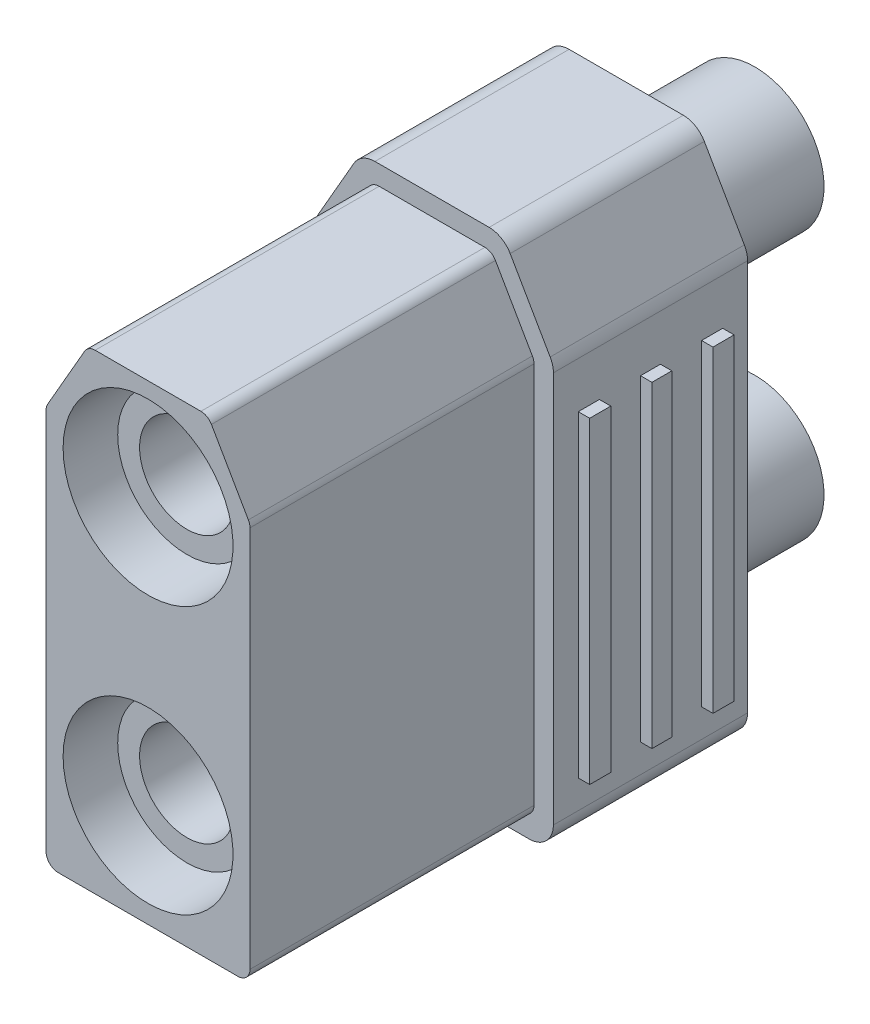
SolidWorks part; units mm, degrees
ref_plane "Front Plane" through (0, 0, 0) normal (0, 0, 1) x (1, 0, 0)
ref_plane "Top Plane" through (0, 0, 0) normal (0, 1, 0) x (1, 0, 0)
ref_plane "Right Plane" through (0, 0, 0) normal (1, 0, 0) x (0, 0, -1)
sketch "Sketch1" plane through (0, 0, 0) normal (0, 0, 1) x (1, 0, 0)
  line L0 (-5, 8.7) -> (-2.931, 12.3)
  line L1 (-5, 8.7) -> (5, 8.7) construction
  line L2 (-5, 8.7) -> (-5, -8.7)
  line L3 (-5, -8.7) -> (5, -8.7)
  line L4 (5, 8.7) -> (5, -8.7)
  line L5 (-5, 8.7) -> (5, -8.7) construction
  line L6 (-5, -8.7) -> (5, 8.7) construction
  line L7 (-2.931, 12.3) -> (2.931, 12.3)
  line L8 (2.931, 12.3) -> (5, 8.7)
  line L9 (0, 0) -> (0, 24.3333) construction
  point P0 (0, 0)
  dimension "D1" = 10
  dimension "D2" = 21
  dimension "D3" = 3.6
extrude "Boss-Extrude1" add sketch "Sketch1" along normal blind 8
sketch "Sketch2" plane through (0, 0, 8) normal (0, 0, 1) x (1, 0, 0)
  line L12 (-4.2, 8.4865) -> (-4.2, -7.9)
  line L13 (-4.2, -7.9) -> (4.2, -7.9)
  line L14 (4.2, -7.9) -> (4.2, 8.4865)
  line L15 (4.2, 8.4865) -> (2.4681, 11.5)
  line L16 (2.4681, 11.5) -> (-2.4681, 11.5)
  line L17 (-2.4681, 11.5) -> (-4.2, 8.4865)
  line L18 (-4.2, 8.4865) -> (-4.2, -7.9)
  line L19 (-4.2, -7.9) -> (4.2, -7.9)
  line L20 (4.2, -7.9) -> (4.2, 8.4865)
  line L21 (4.2, 8.4865) -> (2.4681, 11.5)
  line L22 (2.4681, 11.5) -> (-2.4681, 11.5)
  line L23 (-2.4681, 11.5) -> (-4.2, 8.4865)
  dimension "D1" = 0.8
extrude "Boss-Extrude2" add sketch "Sketch2" along normal blind 11.7
sketch "Sketch3" plane through (0, 0, 0) normal (0, 0, -1) x (-1, 0, 0)
  line L0 (0, -8.7) -> (0, 0) construction
  line L1 (5, -8.7) -> (-5, -8.7) construction
  line L2 (0, 0) -> (0, 12.8337) construction
  circle A0 centre (0, -3.65) radius 3.5
  circle A1 centre (0, 7.35) radius 3.5
  dimension "D3" = 7
  dimension "D4" = 7
  dimension "D1" = 5.05
  dimension "D2" = 11
extrude "Cut-Extrude1" cut sketch "Sketch3" against normal through all
sketch "Sketch4" plane through (0, 0, 0) normal (0, 0, -1) x (-1, 0, 0)
  circle A0 centre (0, 7.35) radius 2.85
  circle A1 centre (0, -3.65) radius 2.85
  dimension "D1" = 5.7
  dimension "D2" = 5.7
extrude "Extrude-Thin1" add sketch "Sketch4" along normal blind 5.3 and the other way offset from surface (18.1 mm away) 1.6 separate body thin
sketch "Sketch5" plane through (5, 0, 0) normal (1, 0, 0) x (0, 0, -1)
  line L0 (-4, -8.7) -> (-4, 8.7) construction
  line L1 (-8, -8.7) -> (0, -8.7) construction
  line L2 (-8, 8.7) -> (0, 8.7) construction
  line L3 (-8, 0) -> (0, 0) construction
  line L4 (-8, -8.7) -> (-8, 8.7) construction
  line L6 (-4.41, -6.535) -> (-3.59, -6.535)
  line L7 (-4.41, -6.535) -> (-4.41, 6.535)
  line L8 (-4.41, 6.535) -> (-3.59, 6.535)
  line L9 (-3.59, -6.535) -> (-3.59, 6.535)
  line L10 (-4.41, -6.535) -> (-3.59, 6.535) construction
  line L11 (-4.41, 6.535) -> (-3.59, -6.535) construction
  line L12 (-6.975, -6.535) -> (-6.105, -6.535)
  line L13 (-6.975, -6.535) -> (-6.975, 6.535)
  line L14 (-6.975, 6.535) -> (-6.105, 6.535)
  line L15 (-6.105, -6.535) -> (-6.105, 6.535)
  line L16 (-6.975, -6.535) -> (-6.105, 6.535) construction
  line L17 (-6.975, 6.535) -> (-6.105, -6.535) construction
  line L18 (-1.895, -6.535) -> (-1.025, -6.535)
  line L19 (-1.895, -6.535) -> (-1.895, 6.535)
  line L20 (-1.895, 6.535) -> (-1.025, 6.535)
  line L21 (-1.025, -6.535) -> (-1.025, 6.535)
  line L22 (-1.895, -6.535) -> (-1.025, 6.535) construction
  line L23 (-1.895, 6.535) -> (-1.025, -6.535) construction
  point P11 (-4, 0)
  point P16 (-6.54, 0)
  point P21 (-1.46, 0)
extrude "Boss-Extrude3" add sketch "Sketch5" along normal blind 0.47
mirror "Mirror1" about plane through (0, 0, 0) normal (1, 0, 0) of "Boss-Extrude3"
fillet "Fillet1" radius 1 6 edges at (5, -8.7, 4) (-5, -8.7, 4) (-5, 8.7, 4) (5, 8.7, 4) (-2.931, 12.3, 4) (2.931, 12.3, 4)
fillet "Fillet2" radius 0.5 6 edges at (-4.2, -7.9, 13.85) (4.2, -7.9, 13.85) (4.2, 8.4865, 13.85) (2.4681, 11.5, 13.85) (-4.2, 8.4865, 13.85) (-2.4681, 11.5, 13.85)
equation "\"D3@Sketch5\"=0.87"
